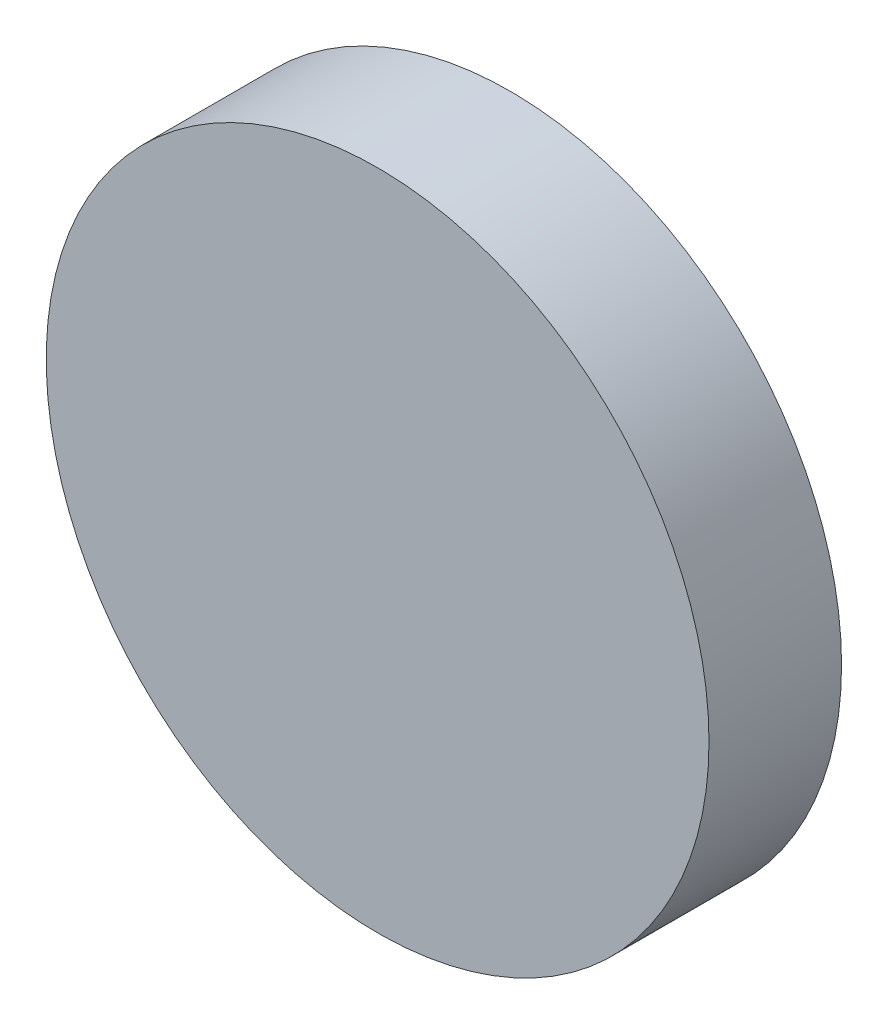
SolidWorks part; units mm, degrees
ref_plane "Спереди" through (0, 0, 0) normal (0, 0, 1) x (1, 0, 0)
ref_plane "Сверху" through (0, 0, 0) normal (0, 1, 0) x (1, 0, 0)
ref_plane "Справа" through (0, 0, 0) normal (1, 0, 0) x (0, 0, -1)
sketch "Эскиз1" plane through (0, 0, 0) normal (0, 0, 1) x (1, 0, 0)
  circle A0 centre (0, 0) radius 5
  dimension "D1" = 10
extrude "Бобышка-Вытянуть1" add sketch "Эскиз1" along normal blind 2
sketch "Эскиз2" plane through (0, 0, 0) normal (0, 0, -1) x (-1, 0, 0)
  circle A0 centre (0, 0) radius 4
  circle A1 centre (0, 0) radius 5 construction
  dimension "D1" = 1
extrude "Вырез-Вытянуть1" cut sketch "Эскиз2" against normal blind 1
